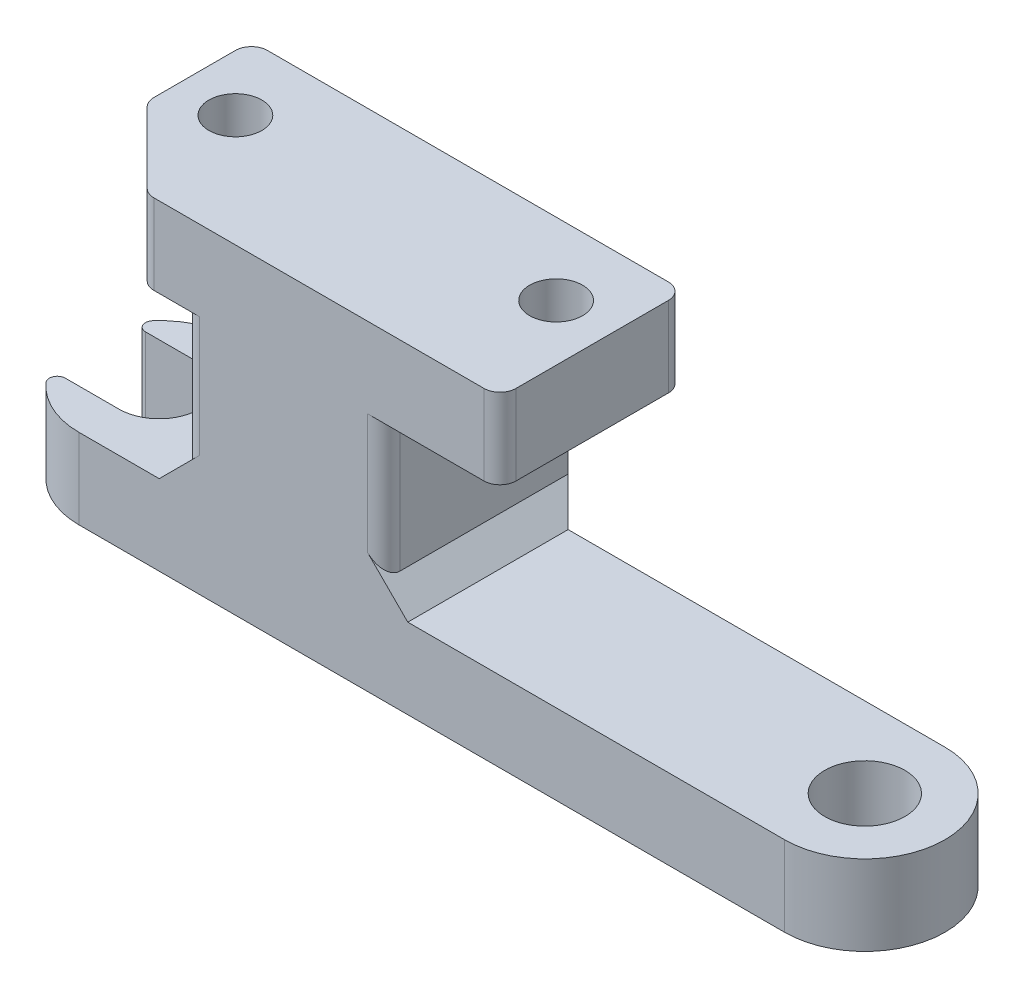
SolidWorks part; units mm, degrees
ref_plane "Ebene vorne" through (0, 0, 0) normal (0, 0, 1) x (1, 0, 0)
ref_plane "Ebene oben" through (0, 0, 0) normal (0, 1, 0) x (1, 0, 0)
ref_plane "Ebene rechts" through (0, 0, 0) normal (1, 0, 0) x (0, 0, -1)
sketch "Skizze1" plane through (0, 0, 0) normal (0, 1, 0) x (1, 0, 0)
  line L1 (-27, 9) -> (27, 9)
  line L2 (-27, 9) -> (-27, -9)
  line L3 (-27, -9) -> (27, -9)
  line L4 (27, 9) -> (27, -9)
  line L5 (-27, 9) -> (27, -9) construction
  line L6 (-27, -9) -> (27, 9) construction
  point P0 (0, 0)
  dimension "D1" = 18
  dimension "D2" = 54
extrude "Aufsatz-Linear austragen1" add sketch "Skizze1" along normal blind 10
hole_wizard "Ø6.6 (6.6) Durchmesser Bohrung1" positions "Skizze2" profile "Skizze3" hole size "Ø6.6" standard "DIN"
sketch "Skizze2" plane through (0, 10, 0) normal (0, 1, 0) x (1, 0, 0)
  line L0 (0, 0) -> (0, 9) construction
  line L1 (27, 9) -> (-27, 9) construction
  line L4 (0, 0) -> (-20, 0) construction
  point P0 (-20, 0)
  point P20 (20, 0)
  dimension "D1" = 40
sketch "Skizze3" plane through (-20, 10, 0) normal (1, 0, 0) x (0, 0, 1)
  line L0 (0, 0) -> (0, 10)
  line L1 (0, 10) -> (3.3, 10)
  line L2 (3.3, 10) -> (3.3, 0)
  line L5 (3.3, 0) -> (0, 0)
  line L11 (0, -6.35) -> (0, 107.95) construction
  dimension "Bohrerdurchmesser" = 6.6
  dimension "Bohrungstiefe" = 10
sketch "Skizze5" plane through (0, 0, 9) normal (0, 0, 1) x (1, 0, 0)
  line L0 (0, 0) -> (0, -30) construction
  line L1 (-12.5, 0) -> (12.5, 0)
  line L2 (-27, 0) -> (27, 0) construction
  line L3 (12.5, 0) -> (12.5, -30)
  line L4 (12.5, -30) -> (-12.5, -30)
  line L5 (-12.5, 0) -> (-12.5, -30)
  dimension "D1" = 30
  dimension "D2" = 25
extrude "Aufsatz-Linear austragen3" add sketch "Skizze5" against normal up to surface (18 mm away)
sketch "Skizze6" plane through (0, 0, 9) normal (0, 0, 1) x (1, 0, 0)
  line L8 (-27, 0) -> (-12.5, 0)
  line L9 (-12.5, 0) -> (-12.5, -30)
  line L10 (-12.5, -30) -> (12.5, -30)
  line L11 (12.5, -30) -> (12.5, 0)
  line L12 (12.5, 0) -> (27, 0)
  line L13 (27, 0) -> (27, 10)
  line L14 (27, 10) -> (-27, 10)
  line L15 (-27, 10) -> (-27, 0)
  line L16 (-27, 0) -> (-12.5, 0)
  line L17 (-12.5, 0) -> (-12.5, -30)
  line L18 (-12.5, -30) -> (12.5, -30)
  line L19 (12.5, -30) -> (12.5, 0)
  line L20 (12.5, 0) -> (27, 0)
  line L21 (27, 0) -> (27, 10)
  line L22 (27, 10) -> (-27, 10)
  line L23 (-27, 10) -> (-27, 0)
  dimension "D1" = 0
extrude "Aufsatz-Linear austragen4" add sketch "Skizze6" along normal blind 5
sketch "Skizze7" plane through (0, -30, 0) normal (0, -1, 0) x (1, 0, 0)
  line L0 (-12.5, 4) -> (-25.5, 4) construction
  line L1 (-12.5, -9) -> (-12.5, 14) construction
  line L2 (-12.5, 14) -> (12.5, 14) construction
  line L3 (-25.5, 4) -> (-25.5, 14) construction
  line L4 (-27, 14) -> (-12.5, 14) construction
  line L5 (-25.5, 4) -> (-35.5, 4) construction
  line L6 (-12.5, 14) -> (-25.5, 14)
  line L7 (12.5, 4) -> (62.5, 4) construction
  line L8 (12.5, -9) -> (12.5, 14) construction
  line L9 (62.5, 4) -> (62.5, 14) construction
  line L10 (62.5, 4) -> (72.5, 4) construction
  line L11 (12.5, 14) -> (62.5, 14)
  line L12 (12.5, -6) -> (12.5, 14)
  line L13 (-12.5, 14) -> (-12.5, -6)
  line L14 (12.5, -6) -> (62.5, -6)
  line L15 (-12.5, -6) -> (-25.5, -6)
  line L16 (-25.5, 9) -> (-34.1603, 9)
  line L17 (-25.5, -1) -> (-34.1603, -1)
  arc A0 (-25.5, -1) -> (-25.5, 9) centre (-25.5, 4) ccw
  arc A1 (-25.5, 14) -> (-34.1603, 9) centre (-25.5, 4) ccw
  circle A2 centre (62.5, 4) radius 5
  arc A3 (62.5, 14) -> (72.5, 4) centre (62.5, 4) cw
  arc A4 (62.5, -6) -> (72.5, 4) centre (62.5, 4) ccw
  arc A5 (-25.5, -6) -> (-34.1603, -1) centre (-25.5, 4) cw
  dimension "D2" = 10
  dimension "D1" = 10
  dimension "D3" = 13
  dimension "D4" = 50
extrude "Aufsatz-Linear austragen5" add sketch "Skizze7" against normal blind 10
chamfer "Fase2" distance 10 angle 45 1 edges at (-27, 5, 14)
chamfer "Fase3" distance 3 angle 45 5 edges at (-12.5, -20, 4) (-12.5, -30, -7.5) (-12.5, -25, -6) (12.5, -20, 4) (12.5, -25, -6)
fillet "Verrundung1" radius 2 7 edges at (-27, 5, -9) (-27, 5, 4) (-17, 5, 14) (-12.5, -8.5, 14) (12.5, -8.5, 14) (27, 5, -9) (27, 5, 14)
fillet "Verrundung2" radius 1 2 edges at (-34.1603, -25, 9) (-34.1603, -25, -1)
